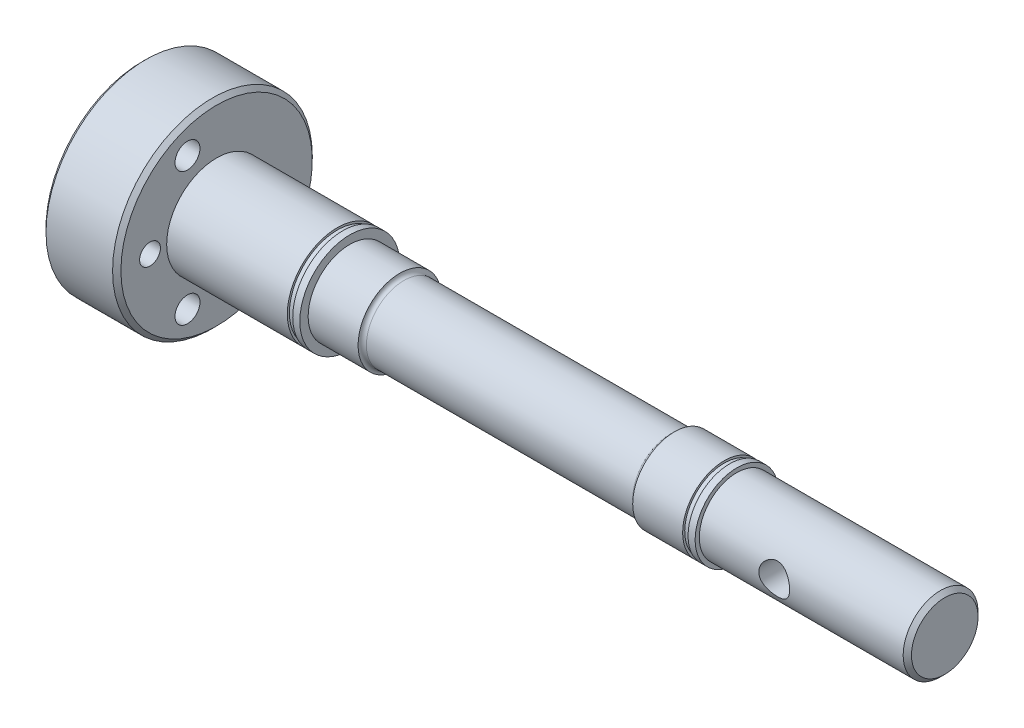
SolidWorks part; units mm, degrees
ref_plane "Plan1" through (0, 0, 0) normal (0, 0, 1) x (1, 0, 0)
ref_plane "Plan2" through (0, 0, 0) normal (0, 1, 0) x (1, 0, 0)
ref_plane "Plan3" through (0, 0, 0) normal (1, 0, 0) x (0, 0, -1)
sketch "Esquisse1" plane through (0, 0, 0) normal (0, 0, 1) x (1, 0, 0)
  line L0 (0, 0) -> (0, 24)
  line L1 (0, 24) -> (18, 24)
  line L2 (18, 24) -> (18, 12)
  line L3 (18, 12) -> (50, 12)
  line L4 (50, 12) -> (50, 10)
  line L5 (50, 10) -> (62, 10)
  line L6 (62, 10) -> (62, 9)
  line L7 (62, 9) -> (128, 9)
  line L8 (128, 9) -> (128, 10)
  line L9 (128, 10) -> (143, 10)
  line L10 (143, 10) -> (143, 9)
  line L11 (143, 9) -> (193, 9)
  line L12 (193, 9) -> (193, 0)
  line L13 (193, 0) -> (0, 0)
  line L14 (-48.7717, 0) -> (219.6628, 0) construction
  dimension "D1" = 18
  dimension "D2" = 32
  dimension "D3" = 12
  dimension "D4" = 66
  dimension "D5" = 15
  dimension "D6" = 50
  dimension "D7" = 9
  dimension "D8" = 10
  dimension "D9" = 9
  dimension "D10" = 10
  dimension "D11" = 12
  dimension "D12" = 24
revolve "Base-Révolution" add sketch "Esquisse1" angle 360 about L14
sketch "Esquisse2" plane through (0, 0, 0) normal (0, 0, 1) x (1, 0, 0)
  line L0 (50, 12) -> (18, 12) construction
  line L1 (47, 11.5) -> (48.3, 11.5)
  line L2 (47, 11.5) -> (47, 12)
  line L3 (47, 12) -> (48.3, 12)
  line L4 (48.3, 11.5) -> (48.3, 12)
  line L5 (18, -24) -> (18, 24) construction
  line L6 (0, 0) -> (53.5601, 0) construction
  line L7 (-48.7717, 0) -> (219.6628, 0) construction
  dimension "D1" = 1.3
  dimension "D2" = 0.5
  dimension "D3" = 29
revolve "Enlèvement de matière-Révolution1" cut sketch "Esquisse2" angle 360 about L6
fillet "Congé1" radius 1
chamfer "Chanfrein1" distance 1 angle 45
sketch "Esquisse3" plane through (0, 0, 0) normal (0, 0, 1) x (1, 0, 0)
  line L0 (17, 0) -> (18, 0) construction
  line L1 (193, -8) -> (193, 8) construction
  circle A0 centre (161, 0) radius 3.7
  dimension "D1" = 7.4
  dimension "D2" = 32
extrude "Enlèv. mat.-Extru.1" cut sketch "Esquisse3" against normal mid plane 20
sketch "Esquisse4" plane through (0, 0, 0) normal (-1, 0, 0) x (0, 0, 1)
  line L0 (-9, 0) -> (9, 0) construction
  circle A0 centre (7, 16) radius 3
  circle A1 centre (7, -16) radius 3
  circle A2 centre (0, 0) radius 24 construction
  circle A3 centre (16, 0) radius 2.5
  dimension "D1" = 6
  dimension "D2" = 6
  dimension "D3" = 32
  dimension "D4" = 16
  dimension "D5" = 7
  dimension "D6" = 7
  dimension "D7" = 5
  dimension "D8" = 16
extrude "Enlèv. mat.-Extru.2" cut sketch "Esquisse4" against normal through all
sketch "Esquisse6" plane through (0, 0, 0) normal (0, 0, 1) x (1, 0, 0)
  line L0 (128, 10) -> (143, 10) construction
  line L1 (140, 9.5) -> (141.3, 9.5)
  line L2 (140, 9.5) -> (140, 10)
  line L3 (140, 10) -> (141.3, 10)
  line L4 (141.3, 9.5) -> (141.3, 10)
  line L5 (50, 12) -> (50, 10) construction
  line L6 (141.5622, 0) -> (160.2295, 0) construction
  line L7 (193, 0) -> (0, 0) construction
  dimension "D1" = 1.3
  dimension "D2" = 0.5
  dimension "D3" = 90
revolve "Enlèvement de matière-Révolution2" cut sketch "Esquisse6" angle 360 about L6
